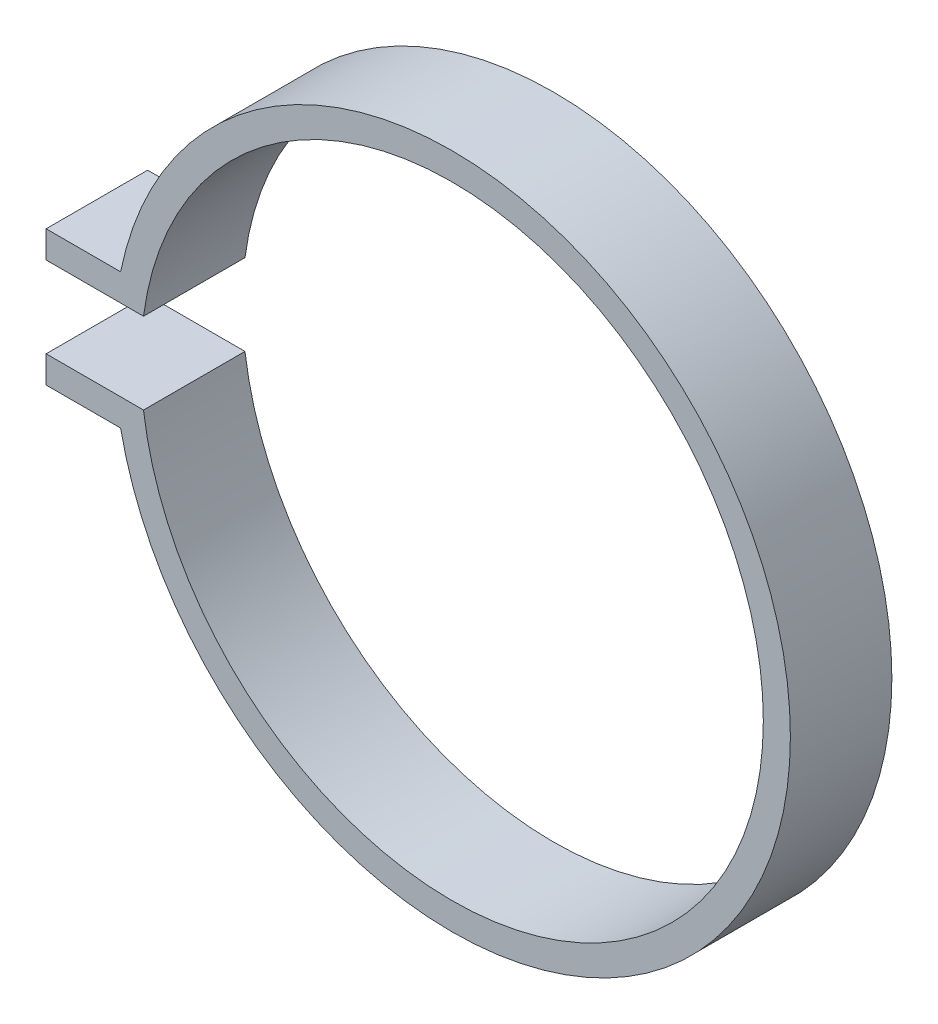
SolidWorks part; units mm, degrees
ref_plane "Front Plane" through (0, 0, 0) normal (0, 0, 1) x (1, 0, 0)
ref_plane "Top Plane" through (0, 0, 0) normal (0, 1, 0) x (1, 0, 0)
ref_plane "Right Plane" through (0, 0, 0) normal (1, 0, 0) x (0, 0, -1)
sketch "Sketch2" plane through (0, 0, 0) normal (0, 0, 1) x (1, 0, 0)
  line L0 (-70.2168, 0) -> (70.1383, 0) construction
  line L1 (-60, 10) -> (-48.9898, 10)
  line L2 (-60, -10) -> (-48.9898, -10)
  line L3 (-60, 10) -> (-60, 6)
  line L4 (-60, 6) -> (-45.607, 6)
  line L6 (-60, -6) -> (-45.607, -6)
  line L7 (-56, 6) -> (-45.607, 6) construction
  line L8 (-56, -6) -> (-45.607, -6) construction
  line L9 (-56, 6) -> (-56, -6) construction
  line L10 (-60, -6) -> (-60, -10)
  line L11 (-60, 10) -> (-60, -10) construction
  arc A1 (-48.9898, -10) -> (-48.9898, 10) centre (0, 0) ccw
  arc A2 (-45.607, -6) -> (-45.607, 6) centre (0, 0) ccw
  dimension "D2" = 50
  dimension "D3" = 60
  dimension "D4" = 20
  dimension "D1" = 4
extrude "Boss-Extrude1" add sketch "Sketch2" along normal blind 15 contours A2 L4 L6
